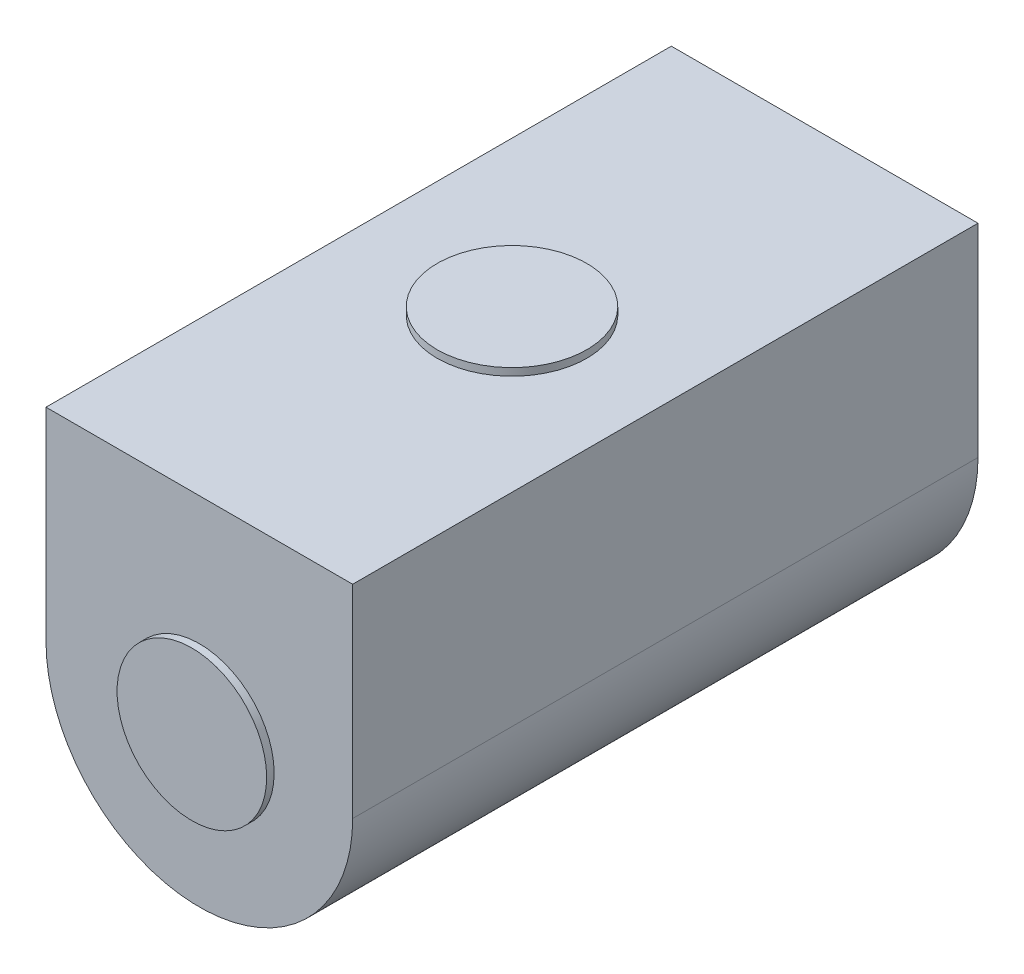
SolidWorks part; units mm, degrees
ref_plane "Front Plane" through (0, 0, 0) normal (0, 0, 1) x (1, 0, 0)
ref_plane "Top Plane" through (0, 0, 0) normal (0, 1, 0) x (1, 0, 0)
ref_plane "Right Plane" through (0, 0, 0) normal (1, 0, 0) x (0, 0, -1)
sketch "Sketch1" plane through (0, 0, 0) normal (0, 0, 1) x (1, 0, 0)
  line L0 (-10.25, 0) -> (-10.25, 13.5625)
  line L1 (-10.25, 13.5625) -> (10.25, 13.5625)
  line L2 (10.25, 13.5625) -> (10.25, 0)
  circle A0 centre (0, 0) radius 5
  circle A1 centre (0, 0) radius 10.25
  point P6 (0, -10.25)
  dimension "D1" = 10
  dimension "D2" = 20.5
  dimension "D3" = 23.8125
extrude "Extrude1" add sketch "Sketch1" along normal mid plane 41.8 contours A1 L2 L1 L0 | A1 A0
sketch "Sketch3" plane through (0, 0, 20.9) normal (0, 0, 1) x (1, 0, 0)
  circle A0 centre (0, 0) radius 5 construction
  circle A1 centre (0, 0) radius 5
extrude "Extrude5" add sketch "Sketch3" along normal blind 0.5
mirror "Mirror1" about plane through (0, 0, 0) normal (0, 0, 1) of "Extrude5"
sketch "Sketch4" plane through (0, 13.5625, 0) normal (0, 1, 0) x (1, 0, 0)
  line L0 (-10.25, 0) -> (10.25, 0) construction
  circle A0 centre (0, 0) radius 5
  dimension "D1" = 10
extrude "Extrude6" add sketch "Sketch4" along normal blind 0.5
